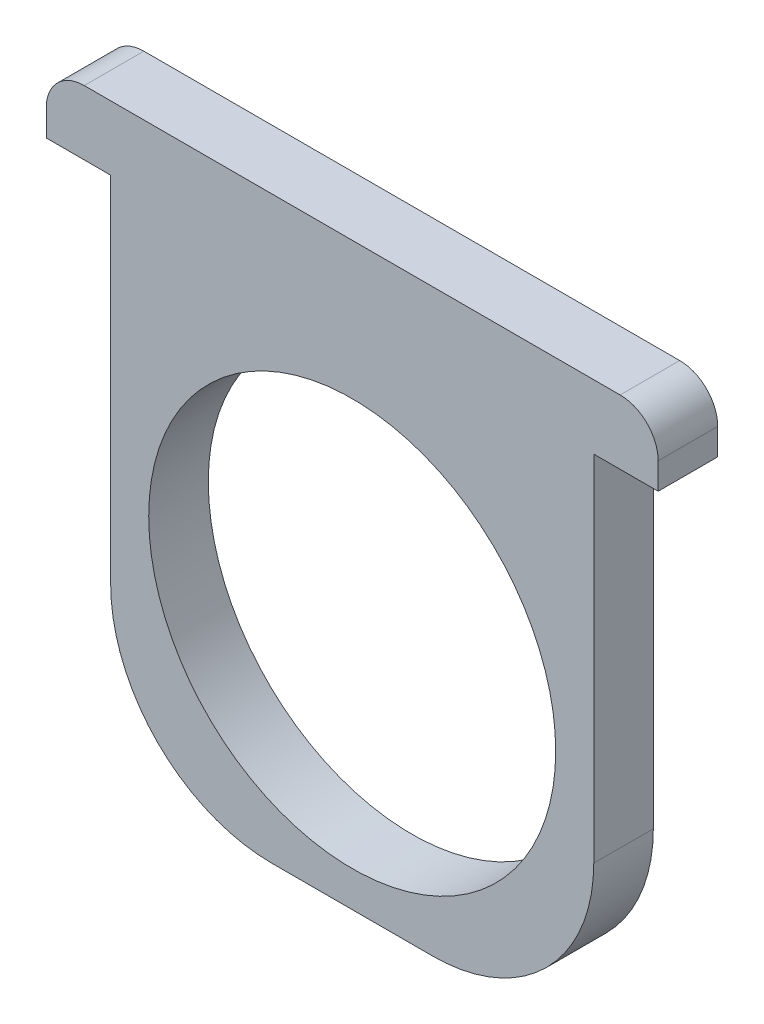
SolidWorks part; units mm, degrees
ref_plane "Front Plane" through (0, 0, 0) normal (0, 0, 1) x (1, 0, 0)
ref_plane "Top Plane" through (0, 0, 0) normal (0, 1, 0) x (1, 0, 0)
ref_plane "Right Plane" through (0, 0, 0) normal (1, 0, 0) x (0, 0, -1)
sketch "Sketch1" plane through (0, 0, 0) normal (0, 0, 1) x (1, 0, 0)
  line L1 (-19.05, -20.32) -> (19.05, -20.32)
  line L2 (-19.05, -20.32) -> (-19.05, 20.32)
  line L3 (-19.05, 20.32) -> (19.05, 20.32)
  line L4 (19.05, -20.32) -> (19.05, 20.32)
  line L5 (-19.05, -20.32) -> (19.05, 20.32) construction
  line L6 (-19.05, 20.32) -> (19.05, -20.32) construction
  line L7 (-24.13, 25.4) -> (24.13, 25.4)
  line L8 (-24.13, 25.4) -> (-24.13, 20.32)
  line L9 (-24.13, 20.32) -> (24.13, 20.32)
  line L10 (24.13, 25.4) -> (24.13, 20.32)
  line L11 (-24.13, 25.4) -> (24.13, 20.32) construction
  line L12 (-24.13, 20.32) -> (24.13, 25.4) construction
  point P0 (0, 0)
  point P6 (0, 22.86)
  dimension "D1" = 38.1
  dimension "D2" = 40.64
  dimension "D3" = 5.08
  dimension "D4" = 5.08
sketch "Sketch2" plane through (0, 0, 0) normal (0, 0, 1) x (1, 0, 0)
  line L0 (19.05, 20.32) -> (24.13, 20.32)
  line L4 (24.13, 25.4) -> (-24.13, 25.4)
  line L5 (24.13, 20.32) -> (24.13, 25.4)
  line L6 (-24.13, 20.32) -> (24.13, 20.32)
  line L7 (-24.13, 25.4) -> (-24.13, 20.32)
  line L8 (24.13, 25.4) -> (-24.13, 25.4)
  line L9 (24.13, 20.32) -> (24.13, 25.4)
  line L10 (-24.13, 20.32) -> (-19.05, 20.32)
  line L11 (-24.13, 25.4) -> (-24.13, 20.32)
  line L12 (-19.05, -20.32) -> (19.05, -20.32)
  line L13 (19.05, -20.32) -> (19.05, 20.32)
  line L14 (19.05, 20.32) -> (-19.05, 20.32)
  line L15 (-19.05, 20.32) -> (-19.05, -20.32)
  line L16 (-19.05, -20.32) -> (19.05, -20.32)
  line L17 (19.05, -20.32) -> (19.05, 20.32)
  line L19 (-19.05, 20.32) -> (-19.05, -20.32)
  dimension "D1" = 0
  dimension "D2" = 0
extrude "Boss-Extrude1" add sketch "Sketch2" along normal mid plane 4.699
sketch "Sketch3" plane through (0, 0, -2.3495) normal (0, 0, -1) x (-1, 0, 0)
  circle A0 centre (0, -1.468) radius 16.05 construction
  circle A1 centre (0, -1.468) radius 16.05
extrude "Cut-Extrude1" cut sketch "Sketch3" against normal through all
fillet "Fillet1" radius 12.7 2 edges at (-19.05, -20.32, 0) (19.05, -20.32, 0)
fillet "Fillet2" radius 3 2 edges at (24.13, 25.4, 0) (-24.13, 25.4, 0)
